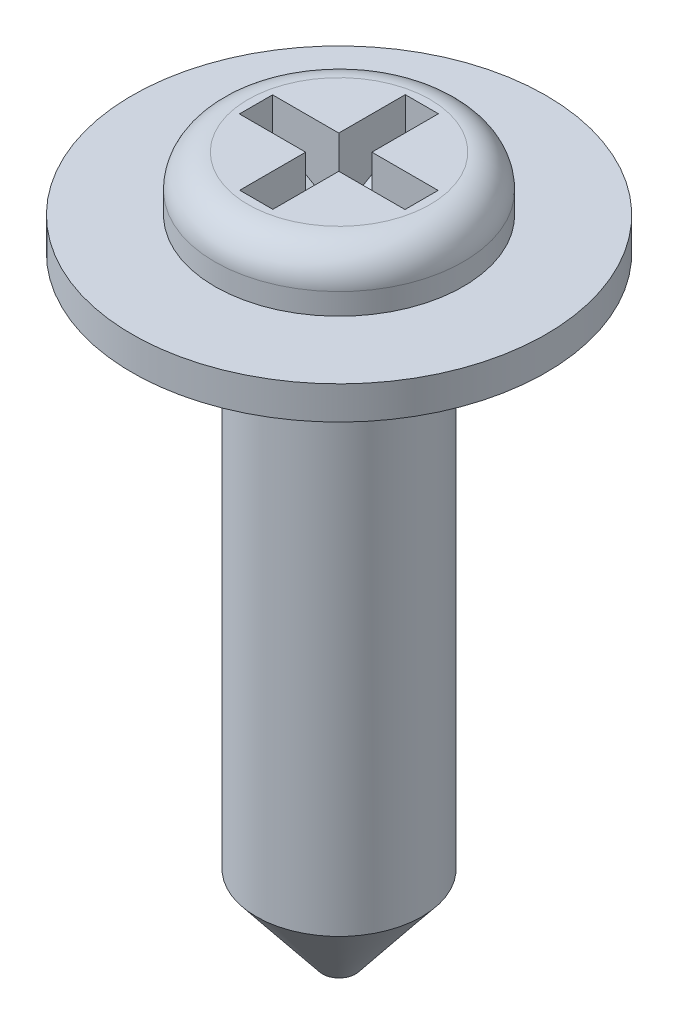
SolidWorks part; units mm, degrees
ref_plane "Plan de face" through (0, 0, 0) normal (0, 0, 1) x (1, 0, 0)
ref_plane "Plan de dessus" through (0, 0, 0) normal (0, 1, 0) x (1, 0, 0)
ref_plane "Plan de droite" through (0, 0, 0) normal (1, 0, 0) x (0, 0, -1)
sketch "Esquisse1" plane through (0, 0, 0) normal (0, 0, 1) x (1, 0, 0)
  line L0 (1.5, -0.4) -> (1.5, -0.658)
  line L2 (1, -1.058) -> (1, -7.5)
  line L3 (0.2, -8.5) -> (0, -8.5)
  line L4 (0, -8.5) -> (0, 0)
  line L5 (0, 0) -> (1.1, 0)
  line L6 (1, -7.5) -> (0.2, -8.5)
  line L8 (1, -1.058) -> (2.5, -1.058)
  line L10 (1.5, -0.658) -> (2.5, -0.658)
  line L11 (2.5, -1.058) -> (2.5, -0.658)
  arc A0 (1.5, -0.4) -> (1.1, 0) centre (1.1, -0.4) ccw
  point P2 (2.5, -0.858)
  point P11 (1.5, 0)
  dimension "D7" = 0.4
  dimension "D1" = 8.5
  dimension "D2" = 2.5
  dimension "D3" = 1
  dimension "D4" = 1.5
  dimension "D5" = 0.8
  dimension "D6" = 1
  dimension "D8" = 0.4
revolve "Révolution1" add sketch "Esquisse1" angle 360 about L4
sketch "Esquisse2" plane through (0, 0, 0) normal (0, 1, 0) x (1, 0, 0)
  line L0 (-0.2, -0.2036) -> (-0.2, -1)
  line L1 (-1, 0.1964) -> (-0.2, 0.1964)
  line L2 (-1, 0.1964) -> (-1, -0.2036)
  line L3 (-1, -0.2036) -> (-0.2, -0.2036)
  line L4 (1, 0.1964) -> (1, -0.2036)
  line L5 (-0.2, 1) -> (0.2, 1)
  line L6 (-0.2, 1) -> (-0.2, 0.1964)
  line L7 (-0.2, -1) -> (0.2, -1)
  line L8 (0.2, 1) -> (0.2, 0.1964)
  line L9 (0.2, 0.1964) -> (1, 0.1964)
  line L10 (0.2, -0.2036) -> (0.2, -1)
  line L11 (0.2, -0.2036) -> (1, -0.2036)
  dimension "D1" = 0.1964
  dimension "D2" = 0.4
  dimension "D3" = 0.2
  dimension "D4" = 0.4
  dimension "D5" = 1
  dimension "D6" = 1
  dimension "D7" = 1
  dimension "D8" = 1
extrude "Enlèv. mat.-Extru.1" cut sketch "Esquisse2" against normal blind 0.8
chamfer "Chanfrein1" distance 0.4 angle 60 4 edges at (-1, -0.8, 0.0036) (0, -0.8, 1) (0, -0.8, -1) (1, -0.8, 0.0036)
